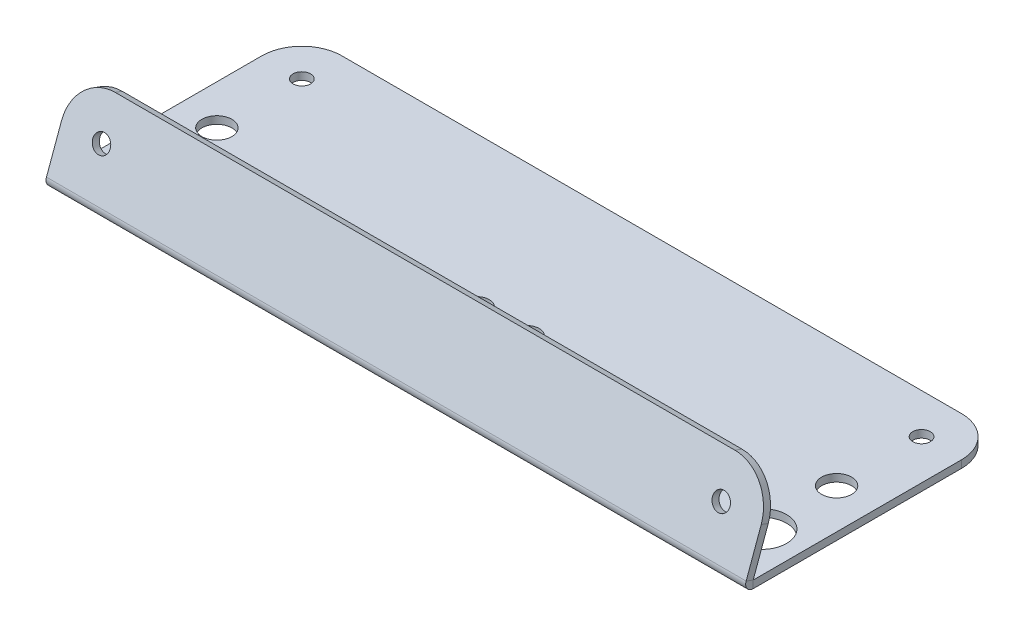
SolidWorks part; units mm, degrees
ref_plane "Front" through (0, 0, 0) normal (0, 0, 1) x (1, 0, 0)
ref_plane "Top" through (0, 0, 0) normal (0, 1, 0) x (1, 0, 0)
ref_plane "Right" through (0, 0, 0) normal (1, 0, 0) x (0, 0, -1)
sketch "Sketch1" plane through (0, 0, 0) normal (0, 1, 0) x (1, 0, 0)
  line L1 (8, 0) -> (132, 0)
  line L2 (0, 8) -> (0, 60)
  line L3 (8, 68) -> (132, 68)
  line L4 (140, 8) -> (140, 60)
  circle A0 centre (65, 38) radius 2.5
  circle A1 centre (75, 38) radius 2.5
  circle A2 centre (8, 60) radius 1.75
  circle A3 centre (132, 60) radius 1.75
  circle A4 centre (132, 8) radius 1.75
  circle A5 centre (8, 8) radius 1.75
  circle A6 centre (8, 43) radius 3
  circle A7 centre (132, 43) radius 3
  circle A8 centre (132, 28) radius 5
  circle A9 centre (8, 28) radius 5
  arc A10 (140, 60) -> (132, 68) centre (132, 60) ccw
  arc A11 (132, 0) -> (140, 8) centre (132, 8) ccw
  arc A12 (0, 8) -> (8, 0) centre (8, 8) ccw
  arc A13 (0, 60) -> (8, 68) centre (8, 60) cw
  point P11 (0, 0)
extrude "Extrude1" add sketch "Sketch1" along normal blind 1.5
sketch "Sketch2" plane through (0, 1.5, 0) normal (0, 1, 0) x (-1, 0, 0)
  line L3 (0, -18.3208) -> (-140, -18.3208)
sheet metal parameters "Sheet-Metal1" parameters "D1"=1.5
flatten bends "Flatten-Bends1" parameters "D1"=0
sketch "Sharp-Sketch1" plane through (0, 1.5, 0) normal (0, 1, 0) x (-1, 0, 0)
process bends "Process-Bends1" parameters "D1"=0
sketch "Flat-Sketch1" plane through (0, 1.5, 0) normal (0, 1, 0) x (-1, 0, 0)
sketched bend "Sketched Bend1" parameters "D1"=0.01
bend "SketchBend1" bend radius 0.01 bend angle 110 parameters "D5"=1
flat pattern "Flat-Pattern1"
sketch "Bend-Lines1" plane through (0, 1.5, 0) normal (0, 1, 0) x (-1, 0, 0)
  line L0 (-140, -17.5708) -> (0, -17.5708) construction
bend of the flat pattern "Flatten-<SketchBend1>1"
